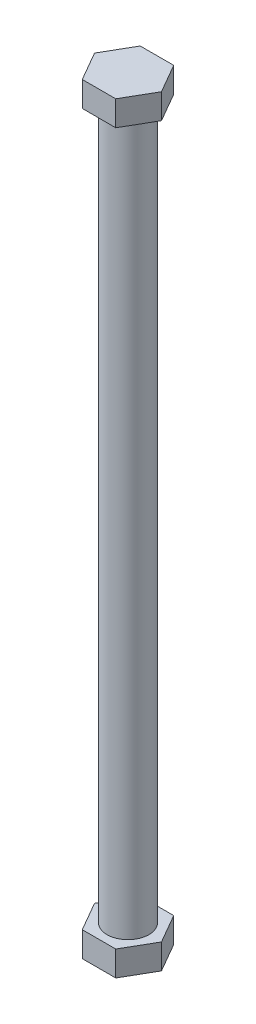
SolidWorks part; units mm, degrees
ref_plane "Front Plane" through (0, 0, 0) normal (0, 0, 1) x (1, 0, 0)
ref_plane "Top Plane" through (0, 0, 0) normal (0, 1, 0) x (1, 0, 0)
ref_plane "Right Plane" through (0, 0, 0) normal (1, 0, 0) x (0, 0, -1)
sketch "Sketch1" plane through (0, 0, 0) normal (0, 1, 0) x (1, 0, 0)
  circle A0 centre (0, 0) radius 3.175
  dimension "D1" = 6.35
extrude "Boss-Extrude1" add sketch "Sketch1" against normal blind 107.95 contours A0
sketch "Sketch2" plane through (0, 0, 0) normal (0, 1, 0) x (1, 0, 0)
  line L1 (2.54, 4.3994) -> (-2.54, 4.3994)
  line L2 (-2.54, 4.3994) -> (-5.08, 0)
  line L3 (-5.08, 0) -> (-2.54, -4.3994)
  line L4 (-2.54, -4.3994) -> (2.54, -4.3994)
  line L5 (2.54, -4.3994) -> (5.08, 0)
  line L6 (5.08, 0) -> (2.54, 4.3994)
  circle A0 centre (0, 0) radius 4.3994 construction
  dimension "D1" = 5.08
extrude "Boss-Extrude2" add sketch "Sketch2" along normal blind 3.81
sketch "Sketch4" plane through (0, -107.95, 0) normal (0, -1, 0) x (1, 0, 0)
  line L1 (2.54, 4.3994) -> (-2.54, 4.3994)
  line L2 (-2.54, 4.3994) -> (-5.08, 0)
  line L3 (-5.08, 0) -> (-2.54, -4.3994)
  line L4 (-2.54, -4.3994) -> (2.54, -4.3994)
  line L5 (2.54, -4.3994) -> (5.08, 0)
  line L6 (5.08, 0) -> (2.54, 4.3994)
  circle A0 centre (0, 0) radius 4.3994 construction
extrude "Boss-Extrude3" add sketch "Sketch4" along normal blind 3.81
